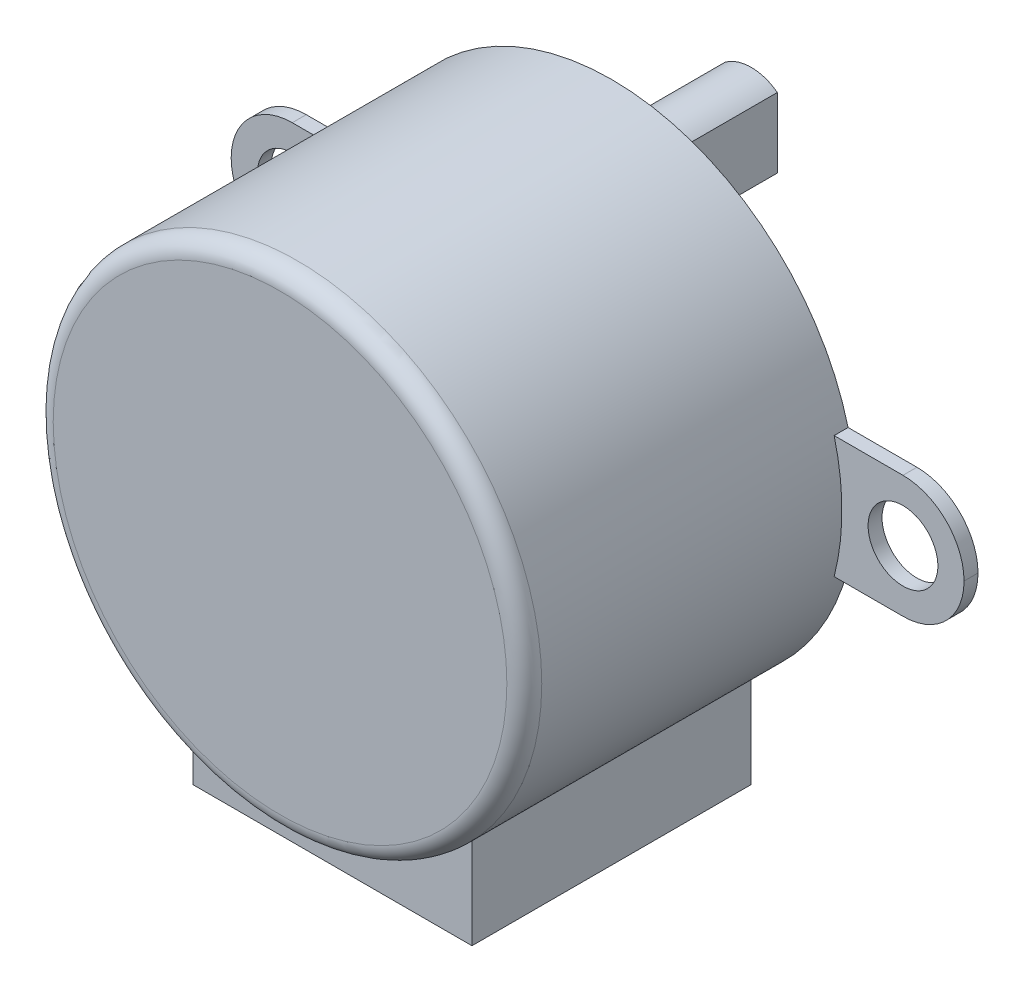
SolidWorks part; units mm, degrees
ref_plane "Plan de face" through (0, 0, 0) normal (0, 0, 1) x (1, 0, 0)
ref_plane "Plan de dessus" through (0, 0, 0) normal (0, 1, 0) x (1, 0, 0)
ref_plane "Plan de droite" through (0, 0, 0) normal (1, 0, 0) x (0, 0, -1)
sketch "Esquisse1" plane through (0, 0, 0) normal (0, 0, 1) x (1, 0, 0)
  circle A0 centre (0, 0) radius 14
  dimension "D1" = 28
extrude "Boss.-Extru.1" add sketch "Esquisse1" along normal blind 19
sketch "Esquisse2" plane through (0, 0, 0) normal (0, 0, -1) x (-1, 0, 0)
  line L0 (0, 0) -> (0, -15.3813) construction
  line L2 (-8, -2) -> (8, -2)
  line L3 (-8, -2) -> (-8, -17)
  line L4 (-8, -17) -> (8, -17)
  line L5 (8, -2) -> (8, -17)
  line L6 (-8, -2) -> (8, -17) construction
  line L7 (-8, -17) -> (8, -2) construction
  point P3 (0, -9.5)
  dimension "D3" = 15
  dimension "D1" = 16
  dimension "D2" = 17
extrude "Boss.-Extru.2" add sketch "Esquisse2" against normal blind 16
fillet "Congé1" radius 1 1 edges at (14, 0, 19)
sketch "Esquisse3" plane through (0, 0, 0) normal (0, 0, -1) x (-1, 0, 0)
  line L0 (-25.1946, 0) -> (25.1946, 0) construction
  line L2 (-21, 3.5) -> (21, 3.5)
  line L3 (-21, 3.5) -> (-21, -3.5)
  line L4 (-21, -3.5) -> (21, -3.5)
  line L5 (21, 3.5) -> (21, -3.5)
  line L6 (-21, 3.5) -> (21, -3.5) construction
  line L7 (-21, -3.5) -> (21, 3.5) construction
  point P3 (0, 0)
  dimension "D1" = 42
  dimension "D2" = 7
  dimension "D3" = 21
extrude "Boss.-Extru.3" add sketch "Esquisse3" against normal blind 0.8
fillet "Congé2" radius 3.5 4 edges at (21, -3.5, 0.4) (21, 3.5, 0.4) (-21, -3.5, 0.4) (-21, 3.5, 0.4)
sketch "Esquisse4" plane through (0, 0, 0) normal (0, 0, -1) x (-1, 0, 0)
  line L0 (0, -2.041) -> (0, 9.7516) construction
  circle A0 centre (-17.5, 0) radius 2
  circle A1 centre (17.5, 0) radius 2
  dimension "D1" = 4
  dimension "D2" = 17.5
extrude "Enlèv. mat.-Extru.1" cut sketch "Esquisse4" against normal blind 0.8
sketch "Esquisse5" plane through (0, 0, 0) normal (0, 0, -1) x (-1, 0, 0)
  line L0 (-13.5554, 3.5) -> (13.5554, 3.5) construction
  line L1 (0, 0) -> (0, 14) construction
  arc A0 (13.5554, 3.5) -> (-13.5554, 3.5) centre (0, 0) ccw construction
  circle A1 centre (0, 8.1) radius 4.6
  dimension "D1" = 9.2
  dimension "D2" = 4.6
extrude "Boss.-Extru.4" add sketch "Esquisse5" along normal blind 1
sketch "Esquisse6" plane through (0, 0, -1) normal (0, 0, -1) x (-1, 0, 0)
  circle A0 centre (0, 8.1) radius 2.5
  dimension "D1" = 5
extrude "Boss.-Extru.5" add sketch "Esquisse6" along normal blind 7
sketch "Esquisse7" plane through (0, 0, -8) normal (0, 0, -1) x (-1, 0, 0)
  line L1 (1.5, 11.1338) -> (5.5443, 11.1338)
  line L2 (1.5, 11.1338) -> (1.5, 4.9746)
  line L3 (1.5, 4.9746) -> (5.5443, 4.9746)
  line L4 (5.5443, 11.1338) -> (5.5443, 4.9746)
  line L5 (-1.5, 11.1338) -> (-5.6185, 11.1338)
  line L6 (-1.5, 11.1338) -> (-1.5, 4.5665)
  line L7 (-1.5, 4.5665) -> (-5.6185, 4.5665)
  line L8 (-5.6185, 11.1338) -> (-5.6185, 4.5665)
  circle A0 centre (0, 8.1) radius 2.5 construction
  dimension "D1" = 1.5
  dimension "D2" = 1.5
extrude "Enlèv. mat.-Extru.2" cut sketch "Esquisse7" against normal blind 5
